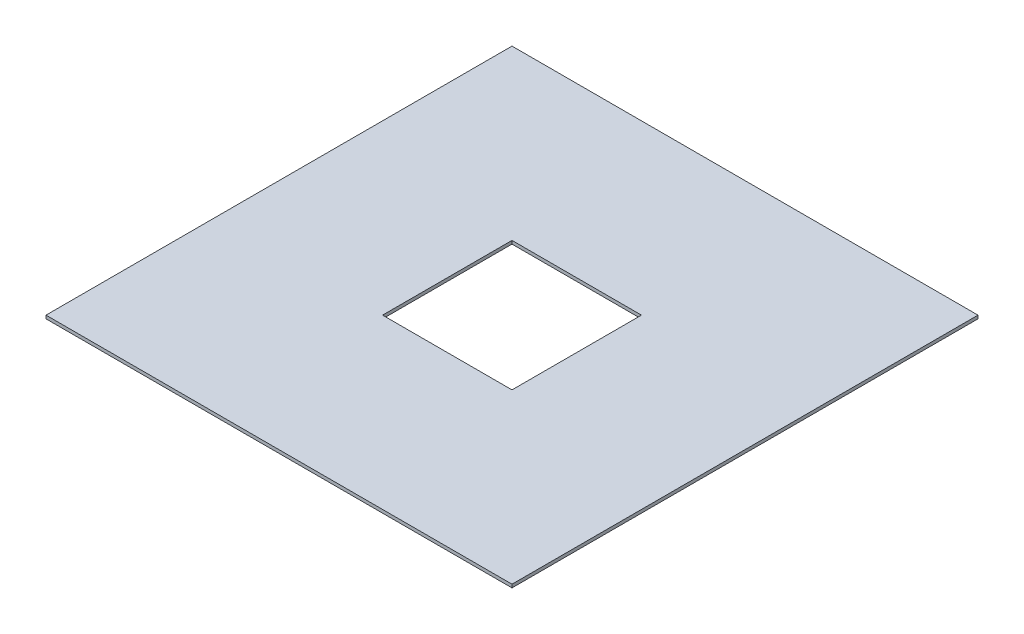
SolidWorks part; units mm, degrees
ref_plane "Front Plane" through (0, 0, 0) normal (0, 0, 1) x (1, 0, 0)
ref_plane "Top Plane" through (0, 0, 0) normal (0, 1, 0) x (1, 0, 0)
ref_plane "Right Plane" through (0, 0, 0) normal (1, 0, 0) x (0, 0, -1)
sketch "Sketch1" plane through (0, 0, 0) normal (0, 1, 0) x (1, 0, 0)
  line L1 (-457.2, 457.2) -> (457.2, 457.2)
  line L2 (-457.2, 457.2) -> (-457.2, -457.2)
  line L3 (-457.2, -457.2) -> (457.2, -457.2)
  line L4 (457.2, 457.2) -> (457.2, -457.2)
  line L5 (-457.2, 457.2) -> (457.2, -457.2) construction
  line L6 (-457.2, -457.2) -> (457.2, 457.2) construction
  point P0 (0, 0)
  dimension "D1" = 914.4
extrude "Boss-Extrude1" add sketch "Sketch1" along normal blind 6.35
sketch "Sketch2" plane through (0, 6.35, 0) normal (0, 1, 0) x (1, 0, 0)
  line L1 (-127, 127) -> (127, 127)
  line L2 (-127, 127) -> (-127, -127)
  line L3 (-127, -127) -> (127, -127)
  line L4 (127, 127) -> (127, -127)
  line L5 (-127, 127) -> (127, -127) construction
  line L6 (-127, -127) -> (127, 127) construction
  point P0 (0, 0)
  dimension "D1" = 254
extrude "Cut-Extrude1" cut sketch "Sketch2" against normal through all
